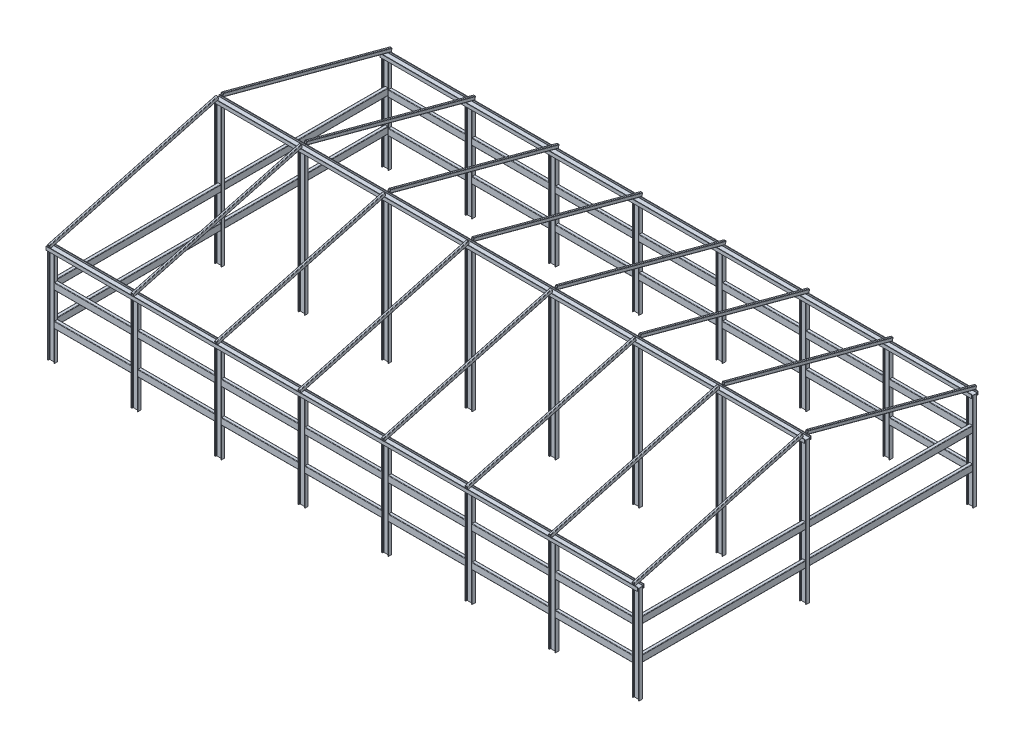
SolidWorks part; units mm, degrees
ref_plane "Front" through (0, 0, 0) normal (0, 0, 1) x (1, 0, 0)
ref_plane "Base Plane" through (0, 0, 0) normal (0, 1, 0) x (1, 0, 0)
ref_plane "Back Plane" through (0, 0, 0) normal (1, 0, 0) x (0, 0, -1)
sketch "Sketch1" plane through (0, 0, 0) normal (0, 1, 0) x (1, 0, 0)
  point P0 (0, 0)
  point P3 (21000, 3000)
  point P4 (3000, 0)
  point P5 (21000, 9000)
  point P6 (6000, 0)
  point P7 (9000, 0)
  point P8 (12000, 0)
  point P9 (15000, 0)
  point P10 (18000, 0)
  point P11 (21000, 0)
  point P12 (6000, 3000)
  point P13 (9000, 3000)
  point P14 (12000, 3000)
  point P15 (15000, 3000)
  point P16 (18000, 3000)
  point P17 (3000, 9000)
  point P19 (3000, 6000)
  point P20 (6000, 6000)
  point P21 (9000, 6000)
  point P23 (12000, 6000)
  point P24 (15000, 6000)
  point P25 (18000, 6000)
  point P26 (21000, 6000)
  point P27 (6000, 9000)
  point P28 (9000, 9000)
  point P29 (12000, 9000)
  point P30 (15000, 9000)
  point P31 (18000, 9000)
  point P32 (0, 3000)
  point P35 (0, 6000)
  point P37 (0, 12000)
  point P38 (3000, 12000)
  point P39 (6000, 12000)
  point P40 (9000, 12000)
  point P41 (12000, 12000)
  point P42 (15000, 12000)
  point P43 (18000, 12000)
  point P44 (21000, 12000)
  point P45 (3000, 3000)
  point P46 (0, 9000)
  dimension "D1" = 8
  dimension "D2" = 5
ref_plane "Front plane" through (21000, 0, 0) normal (1, 0, 0) x (0, 0, -1)
sketch "Sketch15" plane through (0, 0, 0) normal (1, 0, 0) x (0, 0, -1)
  line L0 (0, 3500) -> (6000, 5107.6952)
  line L1 (6000, 5107.6952) -> (12000, 3500)
  line L2 (6000, 1650) -> (6000, -1650) construction
  line L3 (0, 50) -> (0, -50) construction
  dimension "D1" = 75
surface "Roof Surface 1" sketch "Sketch15"
sketch "Sketch124" plane through (21000, 0, 0) normal (1, 0, 0) x (0, 0, -1)
  line L0 (6000, 1650) -> (6000, -1650) construction
  line L1 (-120, 3557.977) -> (-120, 0) construction
  line L2 (-120, 3557.977) -> (5880, 5167.6952)
  line L3 (5880, 5214.4961) -> (5880, 5056.8765) construction
  line L4 (12120, 3557.977) -> (6120, 5167.6952)
  line L5 (6120, 5214.4961) -> (6120, 5056.8765) construction
  line L6 (5880, 5167.6952) -> (5928.2922, 5180.6513)
  line L7 (6120, 5167.6952) -> (6071.7078, 5180.6513)
  point P0 (-120, 3557.977)
  point P1 (6000, 5167.7)
  point P2 (6000, 0)
  dimension "D1" = 3560
  dimension "D2" = 5167.7
  dimension "D3" = 6120
  dimension "D4" = 120
  dimension "D5" = 120
  dimension "D6" = 60
  dimension "D7" = 60
  dimension "D8" = 50
  dimension "D9" = 50
surface "Roof Surface 2" sketch "Sketch124" parameters "D1"=21277, "D2"=50
ref_plane "Top plane" through (0, 3500, 0) normal (0, 1, 0) x (1, 0, 0)
ref_plane "Central Plane" through (0, 0, -6000) normal (0, 0, 1) x (1, 0, 0)
ref_plane "Summit Plane" through (0, 5107.6952, 0) normal (0, 1, 0) x (1, 0, 0)
sketch "Sketch3" plane through (0, 3500, 0) normal (0, 1, 0) x (1, 0, 0)
  point P0 (6000, 6000)
  point P2 (9000, 6000)
  point P4 (12000, 6000)
  point P6 (15000, 6000)
  point P8 (18000, 6000)
  point P10 (21000, 6000)
  point P12 (21000, 3000)
  point P14 (15000, 0)
  point P16 (18000, 0)
  point P18 (21000, 0)
  point P20 (12000, 0)
  point P22 (9000, 0)
  point P24 (6000, 0)
  point P26 (3000, 0)
  point P28 (0, 0)
  point P30 (0, 3000)
  point P32 (3000, 6000)
  point P34 (0, 6000)
  point P36 (0, 9000)
  point P38 (21000, 9000)
  point P40 (0, 12000)
  point P42 (3000, 12000)
  point P44 (6000, 12000)
  point P46 (9000, 12000)
  point P48 (12000, 12000)
  point P50 (15000, 12000)
  point P52 (18000, 12000)
  point P54 (21000, 12000)
ref_plane "V Intermediate Plane 1" through (18000, 0, 0) normal (1, 0, 0) x (0, 0, -1)
ref_plane "V Intermediate Plane 2" through (15000, 0, 0) normal (1, 0, 0) x (0, 0, -1)
ref_plane "V Intermediate Plane 3" through (12000, 0, 0) normal (1, 0, 0) x (0, 0, -1)
ref_plane "V Intermediate Plane 4" through (9000, 0, 0) normal (1, 0, 0) x (0, 0, -1)
ref_plane "V Intermediate Plane 5" through (6000, 0, 0) normal (1, 0, 0) x (0, 0, -1)
ref_plane "V Intermediate Plane 6" through (3000, 0, 0) normal (1, 0, 0) x (0, 0, -1)
ref_plane "H Intermediate Plane 1" through (0, 2400, 0) normal (0, 1, 0) x (1, 0, 0)
ref_plane "H Intermediate Plane 2" through (0, 1200, 0) normal (0, 1, 0) x (1, 0, 0)
ref_plane "Plane30" through (21000, 3615.9276, 135.5474) normal (0, -0.2591, 0.9658) x (1, 0, 0)
sketch "Sketch139" plane through (21000, 3615.9276, 135.5474) normal (0, -0.2591, 0.9658) x (1, 0, 0)
  line L0 (-24, -52) -> (24, -52)
  line L1 (-32, -44) -> (-32, 44)
  line L2 (24, 52) -> (-24, 52)
  line L3 (32, 44) -> (32, -44)
  line L4 (-24, -60) -> (24, -60)
  line L5 (-40, -44) -> (-40, 44)
  line L6 (24, 60) -> (-24, 60)
  line L7 (40, 44) -> (40, -44)
  arc A0 (40, 44) -> (24, 60) centre (24, 44) ccw
  arc A1 (24, -60) -> (40, -44) centre (24, -44) ccw
  arc A2 (-40, -44) -> (-24, -60) centre (-24, -44) ccw
  arc A3 (-24, 60) -> (-40, 44) centre (-24, 44) ccw
  arc A4 (-24, 52) -> (-32, 44) centre (-24, 44) ccw
  arc A5 (32, 44) -> (24, 52) centre (24, 44) ccw
  arc A6 (24, -52) -> (32, -44) centre (24, -44) ccw
  arc A7 (-32, -44) -> (-24, -52) centre (-24, -44) ccw
  point P0 (0, 60)
  point P1 (40, 0)
  point P2 (0, -60)
  point P3 (-40, 0)
  point P4 (-40, 60)
  point P5 (40, 60)
  point P6 (40, -60)
  point P7 (-40, -60)
  point P8 (0, 0)
  point P33 (0, 0)
  dimension "D1" = 16
  dimension "Thickness" = 8
  dimension "V_leg" = 120
  dimension "H_leg" = 80
other "Structure System1"
sketch3d "Structure System Grid8"
  line L0 (18000, 0, 0) -> (18000, 3500, 0)
  line L1 (15000, 0, 0) -> (15000, 3500, 0)
  line L2 (12000, 0, 0) -> (12000, 3500, 0)
  line L3 (9000, 0, 0) -> (9000, 3500, 0)
  line L4 (6000, 0, 0) -> (6000, 3500, 0)
  line L5 (3000, 0, 0) -> (3000, 3500, 0)
  line L6 (0, 0, 0) -> (0, 3500, 0)
  line L7 (21000, 0, -12000) -> (21000, 3500, -12000)
  line L8 (18000, 0, -12000) -> (18000, 3500, -12000)
  line L9 (15000, 0, -12000) -> (15000, 3500, -12000)
  line L10 (12000, 0, -12000) -> (12000, 3500, -12000)
  line L11 (9000, 0, -12000) -> (9000, 3500, -12000)
  line L12 (6000, 0, -12000) -> (6000, 3500, -12000)
  line L13 (3000, 0, -12000) -> (3000, 3500, -12000)
  line L14 (0, 0, -12000) -> (0, 3500, -12000)
  line L15 (21000, 0, 0) -> (21000, 3500, 0)
  line L16 (21000, 0, -6000) -> (21000, 5107.6952, -6000)
  line L17 (18000, 0, -6000) -> (18000, 5107.6952, -6000)
  line L18 (15000, 0, -6000) -> (15000, 5107.6952, -6000)
  line L19 (12000, 0, -6000) -> (12000, 5107.6952, -6000)
  line L20 (9000, 0, -6000) -> (9000, 5107.6952, -6000)
  line L21 (6000, 0, -6000) -> (6000, 5107.6952, -6000)
  line L22 (3000, 0, -6000) -> (3000, 5107.6952, -6000)
  line L23 (0, 0, -6000) -> (0, 5107.6952, -6000)
  line L24 (21000, 2400, 0) -> (21000, 2400, -6000)
  line L25 (21000, 1200, 0) -> (21000, 1200, -6000)
  line L26 (21000, 2400, -6000) -> (21000, 2400, -12000)
  line L27 (21000, 1200, -6000) -> (21000, 1200, -12000)
  line L28 (21000, 2400, -12000) -> (18000, 2400, -12000)
  line L29 (21000, 1200, -12000) -> (18000, 1200, -12000)
  line L30 (18000, 2400, -12000) -> (15000, 2400, -12000)
  line L31 (18000, 1200, -12000) -> (15000, 1200, -12000)
  line L32 (15000, 2400, -12000) -> (12000, 2400, -12000)
  line L33 (15000, 1200, -12000) -> (12000, 1200, -12000)
  line L34 (12000, 2400, -12000) -> (9000, 2400, -12000)
  line L35 (12000, 1200, -12000) -> (9000, 1200, -12000)
  line L36 (9000, 2400, -12000) -> (6000, 2400, -12000)
  line L37 (9000, 1200, -12000) -> (6000, 1200, -12000)
  line L38 (6000, 2400, -12000) -> (3000, 2400, -12000)
  line L39 (6000, 1200, -12000) -> (3000, 1200, -12000)
  line L40 (3000, 2400, -12000) -> (0, 2400, -12000)
  line L41 (3000, 1200, -12000) -> (0, 1200, -12000)
  line L42 (0, 2400, -12000) -> (0, 2400, -6000)
  line L43 (0, 1200, -12000) -> (0, 1200, -6000)
  line L44 (0, 2400, -6000) -> (0, 2400, 0)
  line L45 (0, 1200, -6000) -> (0, 1200, 0)
  line L46 (0, 2400, 0) -> (3000, 2400, 0)
  line L47 (0, 1200, 0) -> (3000, 1200, 0)
  line L48 (3000, 2400, 0) -> (6000, 2400, 0)
  line L49 (3000, 1200, 0) -> (6000, 1200, 0)
  line L50 (6000, 2400, 0) -> (9000, 2400, 0)
  line L51 (6000, 1200, 0) -> (9000, 1200, 0)
  line L52 (9000, 2400, 0) -> (12000, 2400, 0)
  line L53 (9000, 1200, 0) -> (12000, 1200, 0)
  line L54 (12000, 2400, 0) -> (15000, 2400, 0)
  line L55 (12000, 1200, 0) -> (15000, 1200, 0)
  line L56 (15000, 2400, 0) -> (18000, 2400, 0)
  line L57 (15000, 1200, 0) -> (18000, 1200, 0)
  line L58 (18000, 2400, 0) -> (21000, 2400, 0)
  line L59 (18000, 1200, 0) -> (21000, 1200, 0)
  line L60 (-120, 3500, 0) -> (21120, 3500, 0)
  line L61 (-120, 5107.6952, -6000) -> (21120, 5107.6952, -6000)
  line L62 (-120, 3500, -12000) -> (21120, 3500, -12000)
  line L63 (21000, 3615.9276, 135.5474) -> (21000, 5238.602, -5912.7448)
  line L64 (21000, 5238.602, -6087.2552) -> (21000, 3615.9276, -12135.5474)
  line L65 (18000, 3615.9276, 135.5474) -> (18000, 5238.602, -5912.7448)
  line L66 (18000, 5238.602, -6087.2552) -> (18000, 3615.9276, -12135.5474)
  line L67 (15000, 3615.9276, 135.5474) -> (15000, 5238.602, -5912.7448)
  line L68 (15000, 5238.602, -6087.2552) -> (15000, 3615.9276, -12135.5474)
  line L69 (12000, 3615.9276, 135.5474) -> (12000, 5238.602, -5912.7448)
  line L70 (12000, 5238.602, -6087.2552) -> (12000, 3615.9276, -12135.5474)
  line L71 (9000, 3615.9276, 135.5474) -> (9000, 5238.602, -5912.7448)
  line L72 (9000, 5238.602, -6087.2552) -> (9000, 3615.9276, -12135.5474)
  line L73 (6000, 3615.9276, 135.5474) -> (6000, 5238.602, -5912.7448)
  line L74 (6000, 5238.602, -6087.2552) -> (6000, 3615.9276, -12135.5474)
  line L75 (3000, 3615.9276, 135.5474) -> (3000, 5238.602, -5912.7448)
  line L76 (3000, 5238.602, -6087.2552) -> (3000, 3615.9276, -12135.5474)
  line L77 (0, 3615.9276, 135.5474) -> (0, 5238.602, -5912.7448)
  line L78 (0, 5238.602, -6087.2552) -> (0, 3615.9276, -12135.5474)
other "<iso><sb beam><240X24>(4)"
ref_plane "Plane34" through (18000, 0, 0) normal (0, 1, 0) x (0, 0, -1)
sketch "Sketch144" plane through (18000, 0, 0) normal (0, 1, 0) x (0, 0, -1)
  line L0 (-60, -120) -> (-60, -105.666)
  line L1 (-56.6576, -101.7204) -> (-18.6847, -95.3911)
  line L2 (-12, -87.5) -> (-12, 87.5)
  line L3 (-18.6847, 95.3911) -> (-56.6576, 101.7204)
  line L4 (-60, 105.666) -> (-60, 120)
  line L5 (-60, 120) -> (60, 120)
  line L6 (60, 120) -> (60, 105.666)
  line L7 (56.6576, 101.7204) -> (18.6847, 95.3911)
  line L8 (12, 87.5) -> (12, -87.5)
  line L9 (18.6847, -95.3911) -> (56.6576, -101.7204)
  line L10 (60, -105.666) -> (60, -120)
  line L11 (60, -120) -> (-60, -120)
  line L15 (-12, 0) -> (12, 0) construction
  arc A0 (-18.6847, -95.3911) -> (-12, -87.5) centre (-20, -87.5) ccw
  arc A1 (-12, 87.5) -> (-18.6847, 95.3911) centre (-20, 87.5) ccw
  arc A2 (18.6847, 95.3911) -> (12, 87.5) centre (20, 87.5) ccw
  arc A3 (12, -87.5) -> (18.6847, -95.3911) centre (20, -87.5) ccw
  arc A4 (-56.6576, 101.7204) -> (-60, 105.666) centre (-56, 105.666) cw
  arc A5 (56.6576, 101.7204) -> (60, 105.666) centre (56, 105.666) ccw
  arc A6 (-60, -105.666) -> (-56.6576, -101.7204) centre (-56, -105.666) cw
  arc A7 (60, -105.666) -> (56.6576, -101.7204) centre (56, -105.666) ccw
  point P1 (0, 120)
  point P8 (0, -120)
  point P21 (0, 0)
  point P34 (0, 0)
  dimension "RI" = 8
  dimension "D3" = 4
  dimension "BF" = 120
  dimension "D2" = 9.463
  dimension "DEPTH" = 240
  dimension "TW" = 24
  dimension "D1" = 175
other "Member273"
other "Member274"
other "Member275"
other "Member276"
other "Member277"
other "Member278"
other "Member279"
other "Member280"
other "Member281"
other "Member282"
other "Member283"
other "Member284"
other "Member285"
other "Member286"
other "Member287"
other "Member288"
other "Member289"
other "Member290"
other "Member291"
other "Member292"
other "Member293"
other "Member294"
other "Member295"
other "Member296"
other "Member333"
other "Member334"
other "Member335"
other "<iso><rectangular tube><240 X 120 X 12>(4)"
ref_plane "Plane35" through (21000, 2400, 0) normal (0, 0, -1) x (-1, 0, 0)
sketch "Sketch145" plane through (21000, 2400, 0) normal (0, 0, -1) x (-1, 0, 0)
  line L0 (-44, -108) -> (44, -108)
  line L1 (-48, -104) -> (-48, 104)
  line L2 (44, 108) -> (-44, 108)
  line L3 (48, 104) -> (48, -104)
  line L4 (-44, -120) -> (44, -120)
  line L5 (-60, -104) -> (-60, 104)
  line L6 (44, 120) -> (-44, 120)
  line L7 (60, 104) -> (60, -104)
  arc A0 (60, 104) -> (44, 120) centre (44, 104) ccw
  arc A1 (44, -120) -> (60, -104) centre (44, -104) ccw
  arc A2 (-60, -104) -> (-44, -120) centre (-44, -104) ccw
  arc A3 (-44, 120) -> (-60, 104) centre (-44, 104) ccw
  arc A4 (-44, 108) -> (-48, 104) centre (-44, 104) ccw
  arc A5 (48, 104) -> (44, 108) centre (44, 104) ccw
  arc A6 (44, -108) -> (48, -104) centre (44, -104) ccw
  arc A7 (-48, -104) -> (-44, -108) centre (-44, -104) ccw
  point P0 (0, 120)
  point P1 (60, 0)
  point P2 (0, -120)
  point P3 (-60, 0)
  point P4 (-60, 120)
  point P5 (60, 120)
  point P6 (60, -120)
  point P7 (-60, -120)
  point P8 (0, 0)
  point P33 (0, 0)
  dimension "D1" = 16
  dimension "Thickness" = 12
  dimension "V_leg" = 240
  dimension "H_leg" = 120
other "Member297"
other "Member298"
other "Member299"
other "Member300"
other "Member301"
other "Member302"
other "Member303"
other "Member304"
other "Member305"
other "Member306"
other "Member307"
other "Member308"
other "Member309"
other "Member310"
other "Member311"
other "Member312"
other "Member313"
other "Member314"
other "Member315"
other "Member316"
other "Member317"
other "Member318"
other "Member319"
other "Member320"
other "Member321"
other "Member322"
other "Member323"
other "Member324"
other "Member325"
other "Member326"
other "Member327"
other "Member328"
other "Member329"
other "Member330"
other "Member331"
other "Member332"
other "<iso><rectangular tube><120 x 80 x 8>(6)"
ref_plane "Plane36" through (21000, 3615.9276, 135.5474) normal (0, -0.2591, 0.9658) x (1, 0, 0)
sketch "Sketch146" plane through (21000, 3615.9276, 135.5474) normal (0, -0.2591, 0.9658) x (1, 0, 0)
  line L0 (-24, -52) -> (24, -52)
  line L1 (-32, -44) -> (-32, 44)
  line L2 (24, 52) -> (-24, 52)
  line L3 (32, 44) -> (32, -44)
  line L4 (-24, -60) -> (24, -60)
  line L5 (-40, -44) -> (-40, 44)
  line L6 (24, 60) -> (-24, 60)
  line L7 (40, 44) -> (40, -44)
  arc A0 (40, 44) -> (24, 60) centre (24, 44) ccw
  arc A1 (24, -60) -> (40, -44) centre (24, -44) ccw
  arc A2 (-40, -44) -> (-24, -60) centre (-24, -44) ccw
  arc A3 (-24, 60) -> (-40, 44) centre (-24, 44) ccw
  arc A4 (-24, 52) -> (-32, 44) centre (-24, 44) ccw
  arc A5 (32, 44) -> (24, 52) centre (24, 44) ccw
  arc A6 (24, -52) -> (32, -44) centre (24, -44) ccw
  arc A7 (-32, -44) -> (-24, -52) centre (-24, -44) ccw
  point P0 (0, 60)
  point P1 (40, 0)
  point P2 (0, -60)
  point P3 (-40, 0)
  point P4 (-40, 60)
  point P5 (40, 60)
  point P6 (40, -60)
  point P7 (-40, -60)
  point P8 (0, 0)
  point P33 (0, 0)
  dimension "D1" = 16
  dimension "Thickness" = 8
  dimension "V_leg" = 120
  dimension "H_leg" = 80
other "Member336"
other "Member337"
other "Member338"
other "Member339"
other "Member340"
other "Member341"
other "Member342"
other "Member343"
other "Member344"
other "Member345"
other "Member346"
other "Member347"
other "Member348"
other "Member349"
other "Member350"
other "Member351"
other "Corner Management1"
other "Simple Corner Group4"
other "Corner Group1"
other "Corner205"
other "Corner206"
other "Corner207"
other "Corner209"
other "Corner210"
other "Corner211"
other "Corner212"
other "Corner213"
other "Corner214"
other "Corner215"
other "Corner216"
other "Corner217"
other "Corner218"
other "Corner219"
other "Corner220"
other "Corner221"
other "Corner222"
other "Corner223"
other "Corner224"
other "Corner225"
other "Corner226"
other "Corner227"
other "Corner228"
other "Corner229"
other "Complex Corner Group4"
other "Corner Group2"
other "Corner208"
other "Corner233"
other "Corner236"
other "Corner240"
other "Corner252"
other "Corner254"
other "Corner257"
other "Corner259"
other "Corner Group3"
other "Corner230"
other "Corner232"
other "Corner234"
other "Corner235"
other "Corner237"
other "Corner238"
other "Corner239"
other "Corner241"
other "Corner243"
other "Corner244"
other "Corner246"
other "Corner247"
other "Corner248"
other "Corner249"
other "Corner250"
other "Corner251"
other "Corner253"
other "Corner255"
other "Corner256"
other "Corner258"
other "Corner260"
other "Corner262"
other "Corner263"
other "Corner264"
other "Corner Group4"
other "Corner231"
other "Corner242"
other "Corner245"
other "Corner261"
